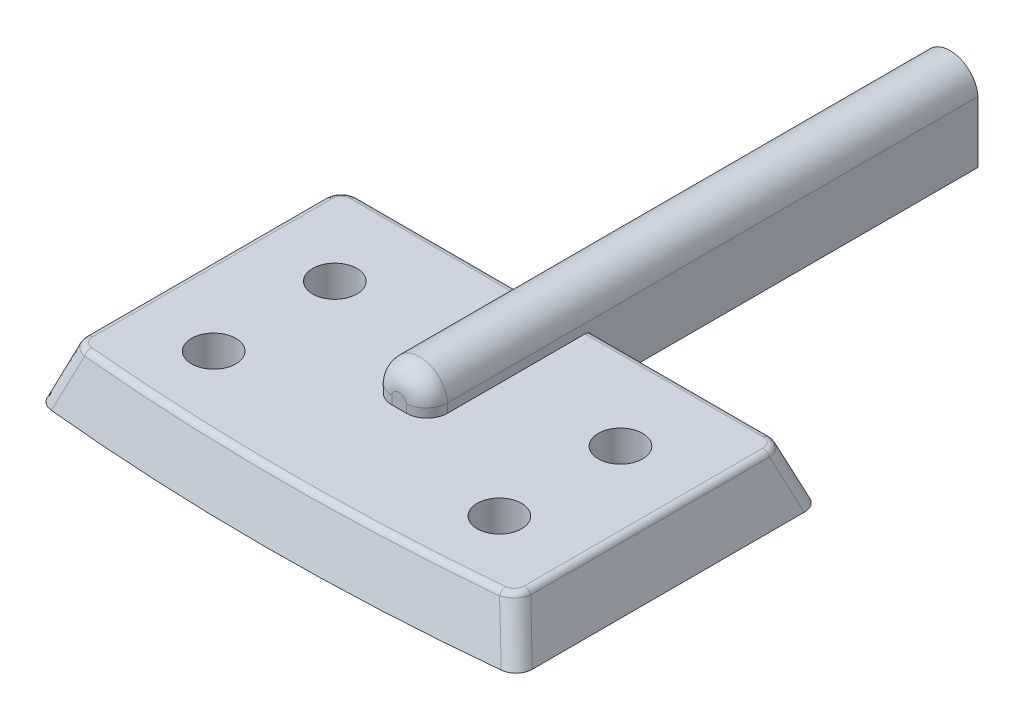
SolidWorks part; units mm, degrees
ref_plane "Front Plane" through (0, 0, 0) normal (0, 0, 1) x (1, 0, 0)
ref_plane "Top Plane" through (0, 0, 0) normal (0, 1, 0) x (1, 0, 0)
ref_plane "Right Plane" through (0, 0, 0) normal (1, 0, 0) x (0, 0, -1)
imported_body "Imported1"
other "Move Face1" parameters "D1"=10
other "Move Face2" parameters "D1"=5
other "Move Face3" parameters "D1"=2.5
other "Move Face4"
other "Move Face5" parameters "D1"=2.5
